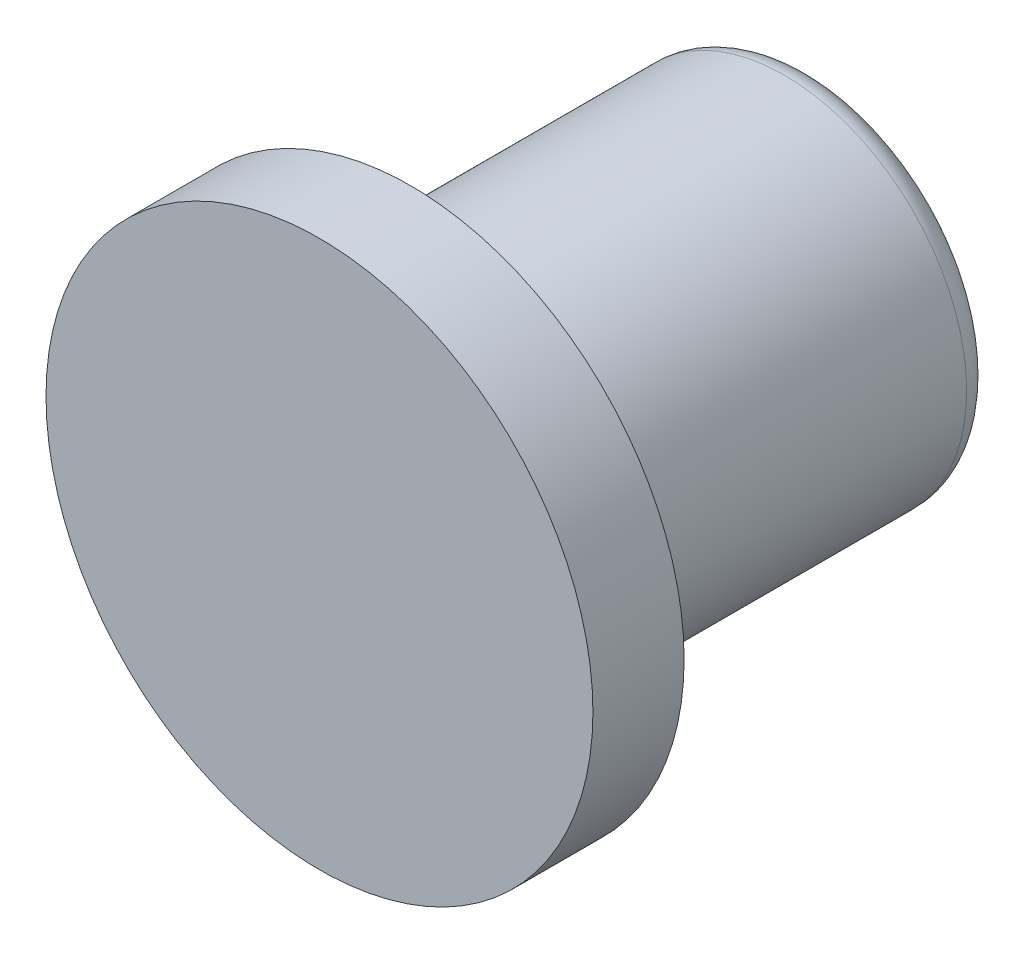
SolidWorks part; units mm, degrees
ref_plane "Front Plane" through (0, 0, 0) normal (0, 0, 1) x (1, 0, 0)
ref_plane "Top Plane" through (0, 0, 0) normal (0, 1, 0) x (1, 0, 0)
ref_plane "Right Plane" through (0, 0, 0) normal (1, 0, 0) x (0, 0, -1)
sketch "Sketch1" plane through (0, 0, 0) normal (1, 0, 0) x (0, 0, -1)
  line L0 (0, 0) -> (27, 0) construction
  line L1 (0, 0) -> (0, 15)
  line L2 (0, 15) -> (5, 15)
  line L3 (5, 15) -> (5, 10)
  line L4 (5, 10) -> (25.5, 10)
  line L5 (27, 8.5) -> (27, 0)
  line L6 (0, 0) -> (27, 0)
  arc A0 (25.5, 10) -> (27, 8.5) centre (25.5, 8.5) cw
  point P9 (27, 10)
  dimension "D5" = 1.5
  dimension "D1" = 5
  dimension "D2" = 15
  dimension "D3" = 10
  dimension "D4" = 22
revolve "Revolve1" add sketch "Sketch1" angle 360 about L0
sketch "Sketch3" plane through (0, 0, 0) normal (1, 0, 0) x (0, 0, -1)
  line L0 (27, 0) -> (19.9899, 0) construction
  line L1 (27, -10) -> (27, 10) construction
  line L2 (27, 3) -> (27, 0)
  line L3 (26.5, 2.5) -> (21, 2.5)
  line L4 (21, 2.5) -> (19.9899, 0)
  line L5 (26.5, 2.5) -> (27, 3)
  line L6 (27, 0) -> (19.9899, 0)
  dimension "D1" = 68
  dimension "D2" = 45
  dimension "D3" = 2.5
  dimension "D4" = 0.5
  dimension "D5" = 6
revolve "Cut-Revolve1" cut sketch "Sketch3" angle 360 about L0
